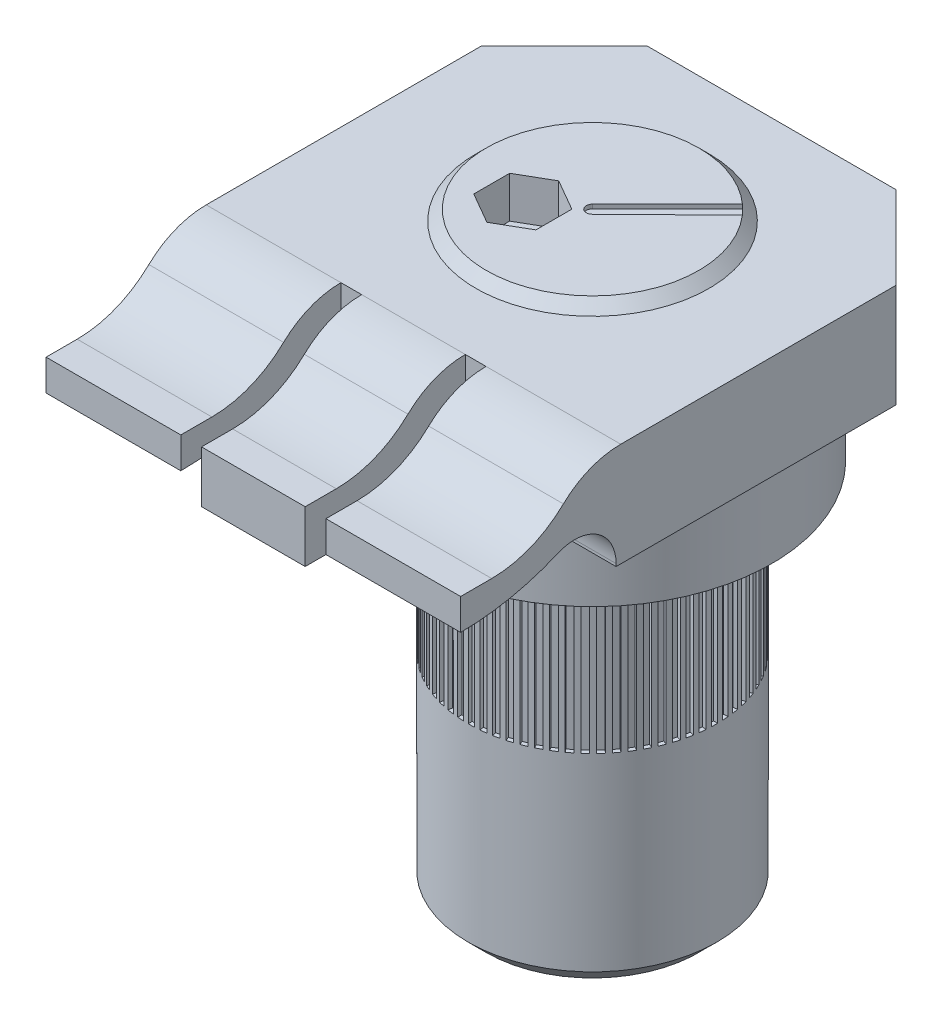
SolidWorks part; units mm, degrees
ref_plane "Front Plane" through (0, 0, 0) normal (0, 0, 1) x (1, 0, 0)
ref_plane "Top Plane" through (0, 0, 0) normal (0, 1, 0) x (1, 0, 0)
ref_plane "Right Plane" through (0, 0, 0) normal (1, 0, 0) x (0, 0, -1)
sketch "Sketch1" plane through (0, 0, 0) normal (1, 0, 0) x (0, 0, -1)
  line L0 (12.5, 0) -> (-12.5, 0)
  line L1 (-12.5, 0) -> (-12.5, 2.5)
  line L2 (-12.5, 2.5) -> (-11, 2.5)
  line L3 (-4.7751, 5) -> (12.5, 5)
  line L4 (12.5, 5) -> (12.5, 0)
  arc A0 (-11, 2.5) -> (-7.5417, 3.8889) centre (-11, 7.5) ccw
  arc A1 (-7.5417, 3.8889) -> (-4.7751, 5) centre (-4.7751, 1) cw
  point P9 (0, 0)
  point P11 (0, 0)
  dimension "D4" = 5
  dimension "D5" = 4
  dimension "D1" = 25
  dimension "D2" = 5
  dimension "D3" = 2.5
  dimension "D6" = 1.5
extrude "Boss-Extrude1" add sketch "Sketch1" along normal mid plane 20
sketch "Sketch2" plane through (0, 0, 0) normal (0, 1, 0) x (1, 0, 0)
  line L0 (10, -12.5) -> (-10, -12.5) construction
  line L1 (-3.5, -4.7751) -> (-2.5, -4.7751)
  line L2 (-3.5, -4.7751) -> (-3.5, -12.5)
  line L3 (-3.5, -12.5) -> (-2.5, -12.5)
  line L4 (-2.5, -4.7751) -> (-2.5, -12.5)
  line L5 (-3.5, -4.7751) -> (-2.5, -12.5) construction
  line L6 (-3.5, -12.5) -> (-2.5, -4.7751) construction
  line L7 (10, -4.7751) -> (-10, -4.7751) construction
  line L8 (-10, -7.5417) -> (-10, -11) construction
  point P0 (-3, -8.6375)
  dimension "D1" = 1
  dimension "D2" = 7
extrude "Cut-Extrude1" cut sketch "Sketch2" along normal up to surface (5 mm away)
mirror "Mirror1" about plane through (0, 0, 0) normal (1, 0, 0) of "Cut-Extrude1"
sketch "Sketch7" plane through (10, 0, 0) normal (1, 0, 0) x (0, 0, -1)
  line L0 (-12.5, 0) -> (-12.5, 1)
  line L1 (-12.5, 2.5) -> (-12.5, 0) construction
  line L2 (-5, 0.1256) -> (-5, 0)
  line L3 (-12.5, 0) -> (12.5, 0) construction
  line L4 (-5, 0) -> (-12.5, 0)
  arc A0 (-12.5, 1) -> (-7.7857, 1.9648) centre (-12.5, 13) ccw
  arc A1 (-7.7857, 1.9648) -> (-5, 0.1256) centre (-7, 0.1256) cw
  dimension "D2" = 12
  dimension "D4" = 2
  dimension "D1" = 1
  dimension "D3" = 7.5
extrude "Cut-Extrude2" cut sketch "Sketch7" against normal up to surface (6.5 mm away)
sketch "Sketch8" plane through (-10, 0, 0) normal (-1, 0, 0) x (0, 0, 1)
  line L0 (12.5, 1) -> (12.5, 0)
  line L1 (12.5, 0) -> (5, 0)
  line L2 (5, 0) -> (5, 0.1256)
  arc A0 (5, 0.1256) -> (7.7857, 1.9648) centre (7, 0.1256) cw
  arc A1 (7.7857, 1.9648) -> (12.5, 1) centre (12.5, 13) ccw
extrude "Cut-Extrude3" cut sketch "Sketch8" against normal up to surface (6.5 mm away)
sketch "Sketch9" plane through (0, 0, 0) normal (0, -1, 0) x (1, 0, 0)
  line L0 (10, -12.5) -> (-10, -12.5) construction
  line L1 (2.5, 4.7751) -> (3.5, 4.7751) construction
  line L2 (10, 5) -> (10, -12.5) construction
  circle A0 centre (0, -3.8625) radius 8.6375
  point P4 (3, 4.7751)
  point P5 (0, 4.7751)
  dimension "D1" = 10
extrude "Boss-Extrude2" add sketch "Sketch9" along normal blind 5
sketch "Sketch10" plane through (0, -5, 0) normal (0, -1, 0) x (1, 0, 0)
  circle A0 centre (0, -3.8625) radius 6
  dimension "D1" = 12
extrude "Boss-Extrude3" add sketch "Sketch10" along normal blind 18
chamfer "Chamfer1" distance 0.875 angle 45 1 edges at (0, -23, -9.8625)
sketch "Sketch13" plane through (0, 0, 0) normal (1, 0, 0) x (0, 0, -1)
  line L0 (3.8625, -18.7589) -> (3.8625, -9.8312) construction
sketch "Sketch14" plane through (0, 0, 0) normal (1, 0, 0) x (0, 0, -1)
  line L0 (3.8625, -23) -> (-0.1375, -23)
  line L1 (-1.2625, -23) -> (8.9875, -23) construction
  line L2 (-0.1375, -23) -> (-0.1375, -23.5)
  line L3 (-0.1375, -23.5) -> (0.3625, -23.5)
  line L4 (0.3625, -23.5) -> (0.3625, -24)
  line L5 (0.3625, -24) -> (3.8625, -24)
  line L6 (3.8625, -24) -> (3.8625, -23)
  line L7 (3.8625, -18.7589) -> (3.8625, -9.8312) construction
  dimension "D1" = 0.5
  dimension "D2" = 4
revolve "Revolve1" add sketch "Sketch14" angle 360 about L0
ref_plane "Plane1" through (6, 0, 0) normal (1, 0, 0) x (0, 0, -1)
sketch "Sketch15" plane through (6, 0, 0) normal (1, 0, 0) x (0, 0, -1)
  line L0 (-2.1375, -5) -> (9.8625, -5) construction
  line L1 (3.6, -13) -> (3.9, -13)
  line L2 (3.6, -13) -> (3.6, -5)
  line L3 (3.6, -5) -> (3.9, -5)
  line L4 (3.9, -13) -> (3.9, -5)
  line L5 (3.6, -13) -> (3.9, -5) construction
  line L6 (3.6, -5) -> (3.9, -13) construction
  line L7 (-5, 0) -> (12.5, 0) construction
  point P0 (3.75, -9)
  point P7 (3.75, -13)
  point P8 (3.75, 0)
  point P9 (3.75, -5)
  dimension "D1" = 0.3
  dimension "D2" = 8
extrude "Cut-Extrude4" cut sketch "Sketch15" against normal blind 0.2
pattern_circular "CirPattern1" count 70 over 360 about axis through (0, 0, -3.8625) along (0, 1, 0) of "Cut-Extrude4"
sketch "Sketch16" plane through (0, 5, 0) normal (0, 1, 0) x (1, 0, 0)
  line L0 (-10, 12.5) -> (-10, -4.7751) construction
  line L1 (10, 12.5) -> (10, -4.7751) construction
  circle A0 centre (0, 3.8625) radius 6
  point P4 (6, 3.8625)
  point P5 (10, 3.8625)
  dimension "D1" = 12
  dimension "D2" = 10
extrude "Boss-Extrude4" add sketch "Sketch16" along normal blind 0.5
chamfer "Chamfer2" distance 0.875 angle 45 1 edges at (0, 5.5, 2.1375)
sketch "Sketch17" plane through (0, 5.5, 0) normal (0, 1, 0) x (1, 0, 0)
  line L0 (10, -12.5) -> (3.5, -12.5) construction
  line L1 (-2, 4.2321) -> (-3.5, 3.366)
  line L2 (-3.5, 3.366) -> (-3.5, 1.634)
  line L3 (-3.5, 1.634) -> (-2, 0.7679)
  line L4 (-2, 0.7679) -> (-0.5, 1.634)
  line L5 (-0.5, 1.634) -> (-0.5, 3.366)
  line L6 (-0.5, 3.366) -> (-2, 4.2321)
  line L7 (-10, 12.5) -> (-10, -4.7751) construction
  circle A0 centre (-2, 2.5) radius 1.5 construction
  circle A1 centre (0, 3.8625) radius 5.125 construction
  dimension "D1" = 3
  dimension "D2" = 15
  dimension "D3" = 8
extrude "Cut-Extrude5" cut sketch "Sketch17" against normal blind 2
sketch "Sketch18" plane through (0, 5.5, 0) normal (0, 1, 0) x (1, 0, 0)
  line L0 (-0.2121, 4.0746) -> (3.4056, 7.6923)
  line L2 (0.21, 3.6482) -> (3.8637, 7.2296)
  line L3 (10, 12.5) -> (-10, 12.5) construction
  line L7 (-0.5, 1.634) -> (-0.5, 3.366) construction
  arc A0 (-0.2121, 4.0746) -> (0.21, 3.6482) centre (0, 3.8625) ccw
  arc A1 (3.8637, 7.2296) -> (3.4056, 7.6923) centre (0, 3.8625) ccw
  circle A2 centre (0, 3.8625) radius 5.125 construction
  point P7 (0, 0)
  point P10 (0, 3.8625)
  point P11 (5.125, 3.8625)
  point P13 (0, 3.8625)
  dimension "D2" = 0.3
  dimension "D1" = 45
  dimension "D3" = 0.71
extrude "Cut-Extrude6" cut sketch "Sketch18" against normal blind 0.2
chamfer "Chamfer3" distance 4 angle 45 2 edges at (-10, 2.5, -12.5) (10, 2.5, -12.5)
